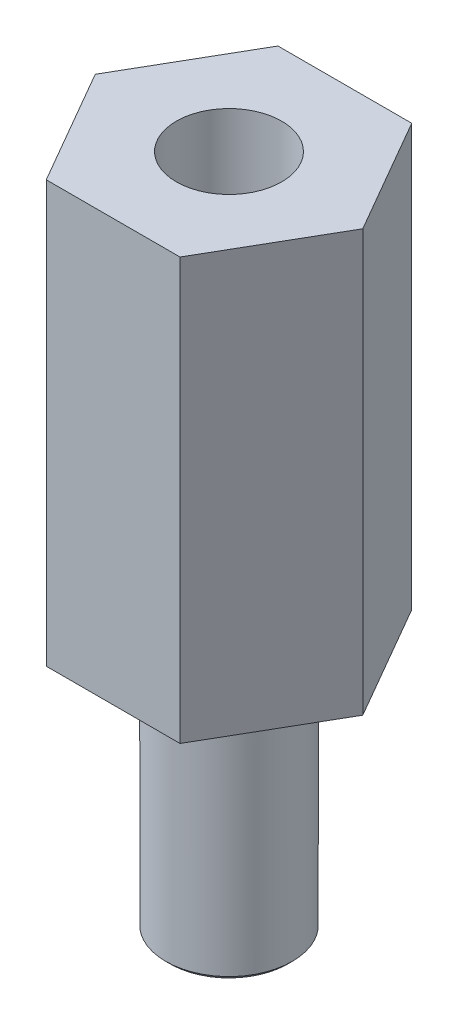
SolidWorks part; units mm, degrees
ref_plane "Спереди" through (0, 0, 0) normal (0, 0, 1) x (1, 0, 0)
ref_plane "Сверху" through (0, 0, 0) normal (0, 1, 0) x (1, 0, 0)
ref_plane "Справа" through (0, 0, 0) normal (1, 0, 0) x (0, 0, -1)
sketch "Эскиз1" plane through (0, 0, 0) normal (0, 1, 0) x (1, 0, 0)
  line L1 (3.1754, 0) -> (1.5877, 2.75)
  line L2 (1.5877, 2.75) -> (-1.5877, 2.75)
  line L3 (-1.5877, 2.75) -> (-3.1754, 0)
  line L4 (-3.1754, 0) -> (-1.5877, -2.75)
  line L5 (-1.5877, -2.75) -> (1.5877, -2.75)
  line L6 (1.5877, -2.75) -> (3.1754, 0)
  circle A0 centre (0, 0) radius 2.75 construction
  circle A1 centre (0, 0) radius 1.25
  dimension "D2" = 2.5
  dimension "D1" = 5.5
extrude "Бобышка-Вытянуть1" add sketch "Эскиз1" along normal blind 10
sketch "Эскиз2" plane through (0, 0, 0) normal (0, -1, 0) x (1, 0, 0)
  circle A0 centre (0, 0) radius 1.5
  dimension "D1" = 3
extrude "Бобышка-Вытянуть2" add sketch "Эскиз2" along normal blind 6
chamfer "Фаска1" distance 0.1 angle 45 1 edges at (0, -6, -1.5)
